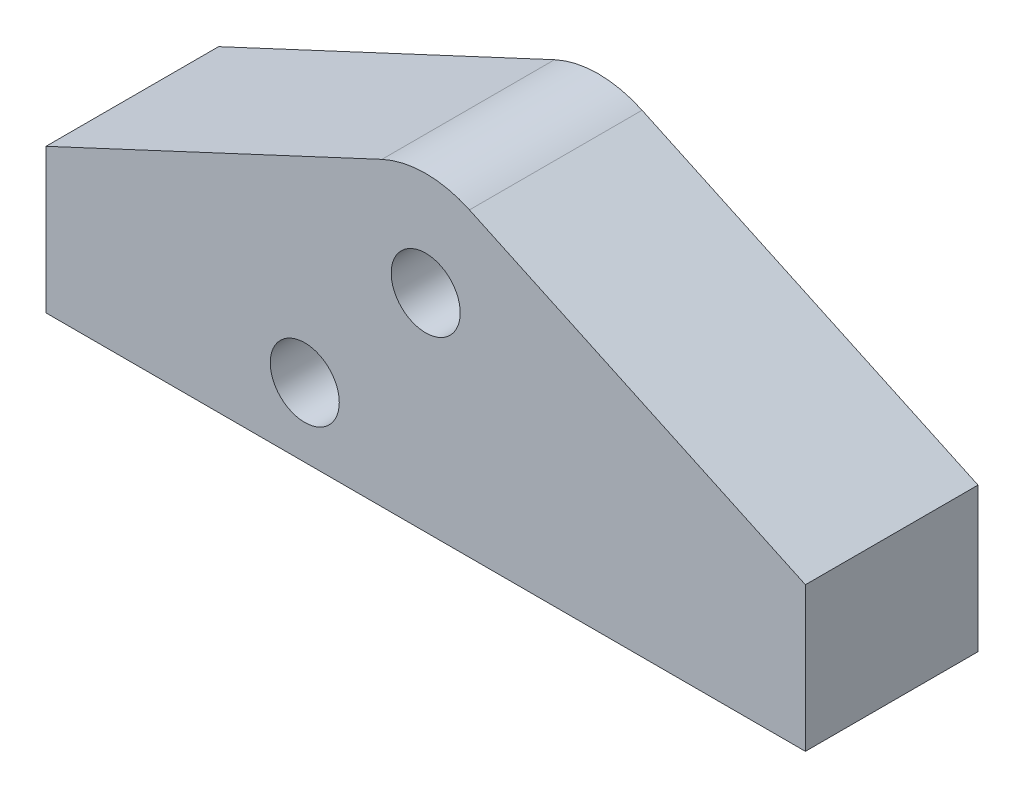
SolidWorks part; units mm, degrees
ref_plane "Front Plane" through (0, 0, 0) normal (0, 0, 1) x (1, 0, 0)
ref_plane "Top Plane" through (0, 0, 0) normal (0, 1, 0) x (1, 0, 0)
ref_plane "Right Plane" through (0, 0, 0) normal (1, 0, 0) x (0, 0, -1)
sketch "Sketch1" plane through (0, 0, 0) normal (0, 0, 1) x (1, 0, 0)
  line L0 (-34.925, -19.05) -> (34.925, -19.05)
  line L1 (34.925, -19.05) -> (34.925, -5.7761)
  line L2 (-34.925, -19.05) -> (-34.925, -5.7761)
  line L3 (-34.925, -5.7761) -> (-4.0254, 8.6326)
  line L4 (34.925, -5.7761) -> (4.0254, 8.6326)
  line L5 (0, 0) -> (0, -15.0312) construction
  line L6 (-25.4, -19.05) -> (-25.4, -5.3402) construction
  line L7 (25.4, -19.05) -> (25.4, -5.3402) construction
  circle A0 centre (0, 0) radius 3.175
  arc A1 (4.0254, 8.6326) -> (-4.0254, 8.6326) centre (0, 0) ccw
  circle A2 centre (-11.1252, -12.7) radius 3.175
  dimension "D2" = 6.35
  dimension "D3" = 9.525
  dimension "D1" = 69.85
  dimension "D4" = 19.05
  dimension "D5" = 13.2739
  dimension "D6" = 50.8
  dimension "D7" = 28.575
  dimension "D8" = 25
  dimension "D9" = 11.1252
  dimension "D10" = 6.35
sketch "Sketch2" plane through (0, 0, 0) normal (0, 0, 1) x (1, 0, 0)
  line L0 (-34.925, -19.05) -> (34.925, -19.05) construction
  line L1 (34.925, -19.05) -> (34.925, -5.7761) construction
  line L2 (34.925, -5.7761) -> (4.0254, 8.6326) construction
  line L3 (-34.925, -5.7761) -> (-4.0254, 8.6326) construction
  line L4 (-34.925, -19.05) -> (-34.925, -5.7761) construction
  line L5 (-34.925, -19.05) -> (34.925, -19.05)
  line L6 (34.925, -19.05) -> (34.925, -5.7761)
  line L7 (34.925, -5.7761) -> (4.0254, 8.6326)
  line L8 (-34.925, -5.7761) -> (-4.0254, 8.6326)
  line L9 (-34.925, -19.05) -> (-34.925, -5.7761)
  arc A0 (4.0254, 8.6326) -> (-4.0254, 8.6326) centre (0, 0) ccw construction
  circle A1 centre (0, 0) radius 3.175 construction
  arc A2 (4.0254, 8.6326) -> (-4.0254, 8.6326) centre (0, 0) ccw
  circle A3 centre (0, 0) radius 3.175
  circle A4 centre (-11.1252, -12.7) radius 3.175 construction
  circle A5 centre (-11.1252, -12.7) radius 3.175
extrude "Boss-Extrude1" add sketch "Sketch2" along normal blind 9.525 and the other way blind 6.35
sketch "Sketch3" plane through (0, -19.05, 0) normal (0, -1, 0) x (1, 0, 0)
  circle A0 centre (-25.4, 0) radius 3.175
  circle A1 centre (25.4, 0) radius 3.175
  dimension "D1" = 6.35
extrude "Cut-Extrude1" cut sketch "Sketch3" against normal blind 15.875
